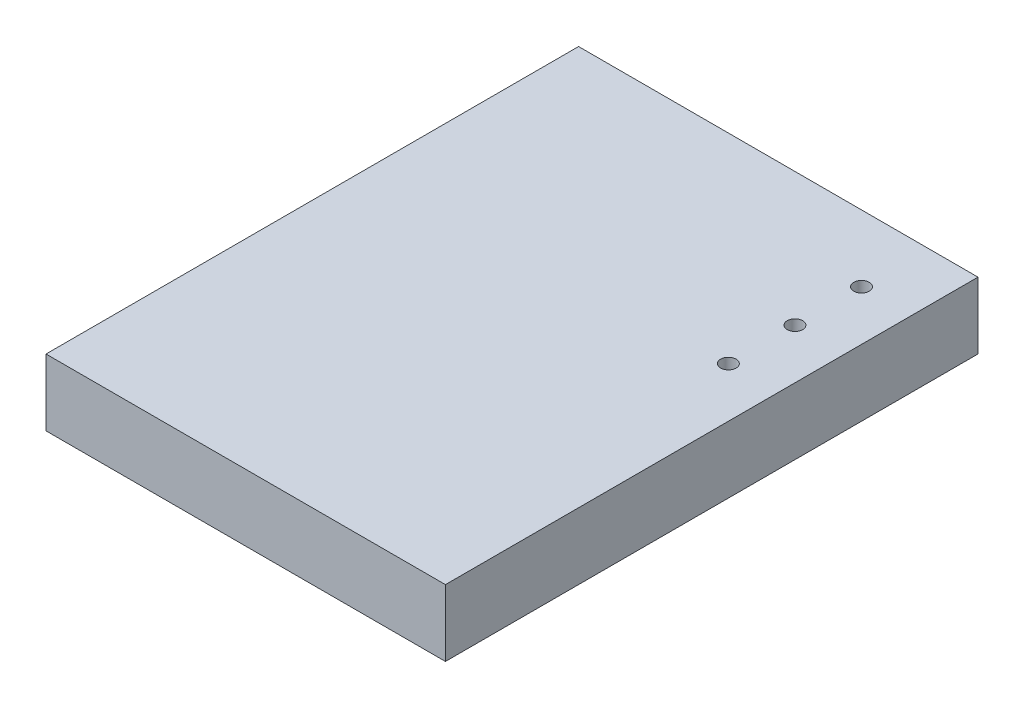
SolidWorks part; units mm, degrees
ref_plane "Front Plane" through (0, 0, 0) normal (0, 0, 1) x (1, 0, 0)
ref_plane "Top Plane" through (0, 0, 0) normal (0, 1, 0) x (1, 0, 0)
ref_plane "Right Plane" through (0, 0, 0) normal (1, 0, 0) x (0, 0, -1)
sketch "Sketch1" plane through (0, 0, 0) normal (0, 1, 0) x (1, 0, 0)
  line L1 (0, 0) -> (76.2, 0)
  line L2 (0, 0) -> (0, -101.6)
  line L3 (0, -101.6) -> (76.2, -101.6)
  line L4 (76.2, 0) -> (76.2, -101.6)
  dimension "D1" = 101.6
  dimension "D2" = 76.2
extrude "Boss-Extrude1" add sketch "Sketch1" along normal blind 12.7
sketch "Sketch2" plane through (0, 12.7, 0) normal (0, 1, 0) x (1, 0, 0)
  line L0 (66.675, 0) -> (66.675, -12.7) construction
  line L1 (76.2, 0) -> (0, 0) construction
  line L2 (0, -101.6) -> (76.2, -101.6) construction
  line L3 (57.15, 0) -> (57.15, -101.6) construction
  line L4 (76.2, -101.6) -> (76.2, 0) construction
  line L5 (57.15, 0) -> (66.675, 0) construction
  line L6 (66.675, 0) -> (76.2, 0) construction
  line L7 (66.675, -12.7) -> (66.675, -25.4) construction
  line L8 (66.675, -25.4) -> (66.675, -38.1) construction
  line L9 (66.675, -38.1) -> (66.675, -50.8) construction
  line L10 (57.15, -50.8) -> (74.2, -50.8) construction
  circle A1 centre (66.675, -12.7) radius 1.48
  circle A2 centre (66.675, -25.4) radius 1.48
  circle A3 centre (66.675, -38.1) radius 1.48
  dimension "D2" = 2.96
  dimension "D1" = 19.05
extrude "Cut-Extrude1" cut sketch "Sketch2" against normal through all and the other way through all
